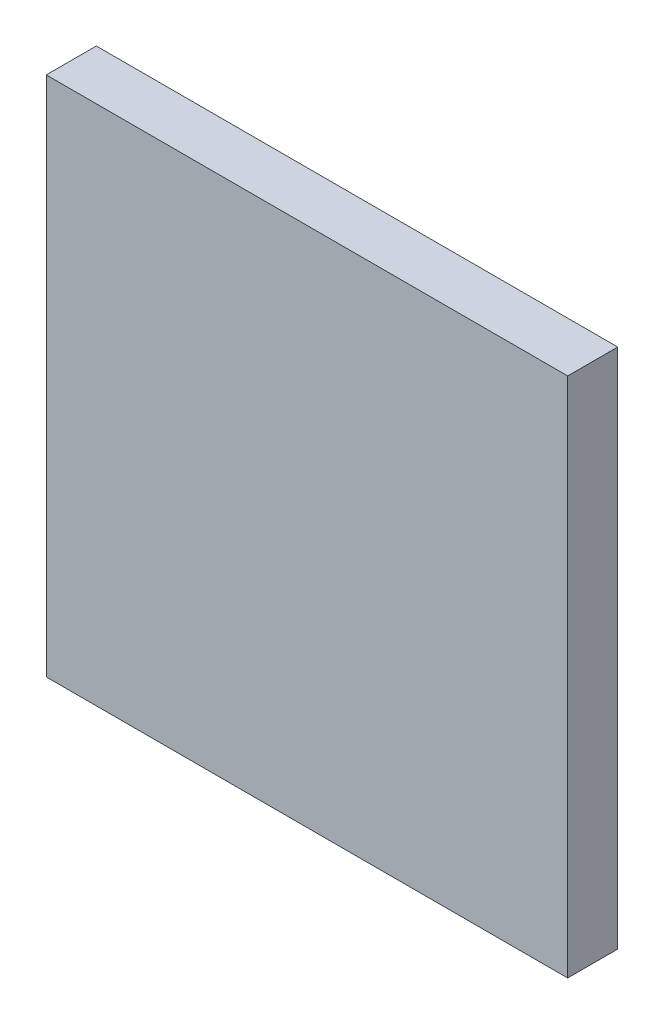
SolidWorks part; units mm, degrees
ref_plane "Front Plane" through (0, 0, 0) normal (0, 0, 1) x (1, 0, 0)
ref_plane "Top Plane" through (0, 0, 0) normal (0, 1, 0) x (1, 0, 0)
ref_plane "Right Plane" through (0, 0, 0) normal (1, 0, 0) x (0, 0, -1)
sketch "Sketch1" plane through (0, 0, 0) normal (0, 0, 1) x (1, 0, 0)
  line L1 (0, 0) -> (12.7, 0)
  line L2 (0, 0) -> (0, -12.7)
  line L3 (0, -12.7) -> (12.7, -12.7)
  line L4 (12.7, 0) -> (12.7, -12.7)
  dimension "D1" = 12.7
  dimension "D2" = 12.7
base flange "Base-Flange1" sketch "Sketch1" thickness 1.2192 reverse thickness direction no parameters "D1"=0.7366
sketch "Bend-Lines1" [suppressed] plane through (0, 0, 0) normal (0, 1, 0) x (1, 0, 0)
sketch "Bounding-Box1" [suppressed] plane through (0, 0, 0) normal (0, 1, 0) x (1, 0, 0)
sheet metal parameters "Sheet-Metal1" thickness 1.2192 parameters "D1"=0.7366
flat pattern "Flat-Pattern1"
sketch "Bend-Lines2" plane through (0, 0, 0) normal (0, 1, 0) x (1, 0, 0)
sketch3d "Bounding-Box2" [suppressed]
  line L0 (0, -12.7, 0) -> (12.7, -12.7, 0) construction
  line L1 (0, 0, 0) -> (12.7, 0, 0) construction
  line L2 (0, -12.7, 0) -> (0, 0, 0) construction
  line L3 (12.7, -12.7, 0) -> (12.7, 0, 0) construction
